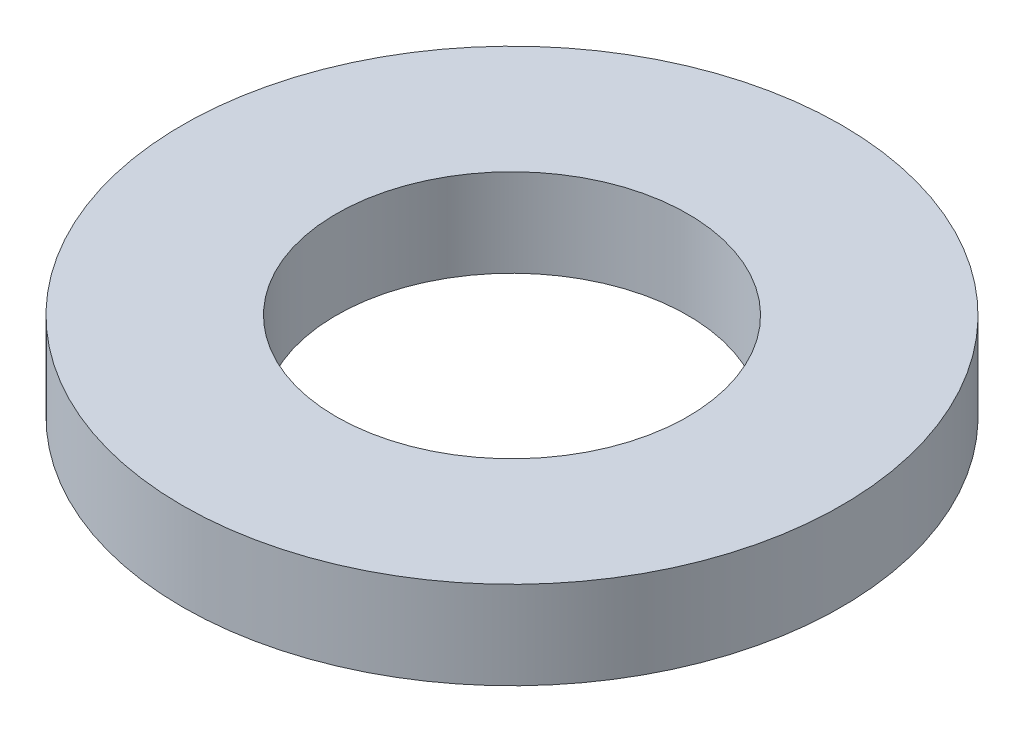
SolidWorks part; units mm, degrees
ref_plane "Front" through (0, 0, 0) normal (0, 0, 1) x (1, 0, 0)
ref_plane "Top" through (0, 0, 0) normal (0, 1, 0) x (1, 0, 0)
ref_plane "Right" through (0, 0, 0) normal (1, 0, 0) x (0, 0, -1)
sketch "Sketch1" plane through (0, 0, 0) normal (0, 1, 0) x (1, 0, 0)
  circle A0 centre (0, 0) radius 3.2
  circle A1 centre (0, 0) radius 6
extrude "Extrude1" add sketch "Sketch1" along normal blind 1.6
